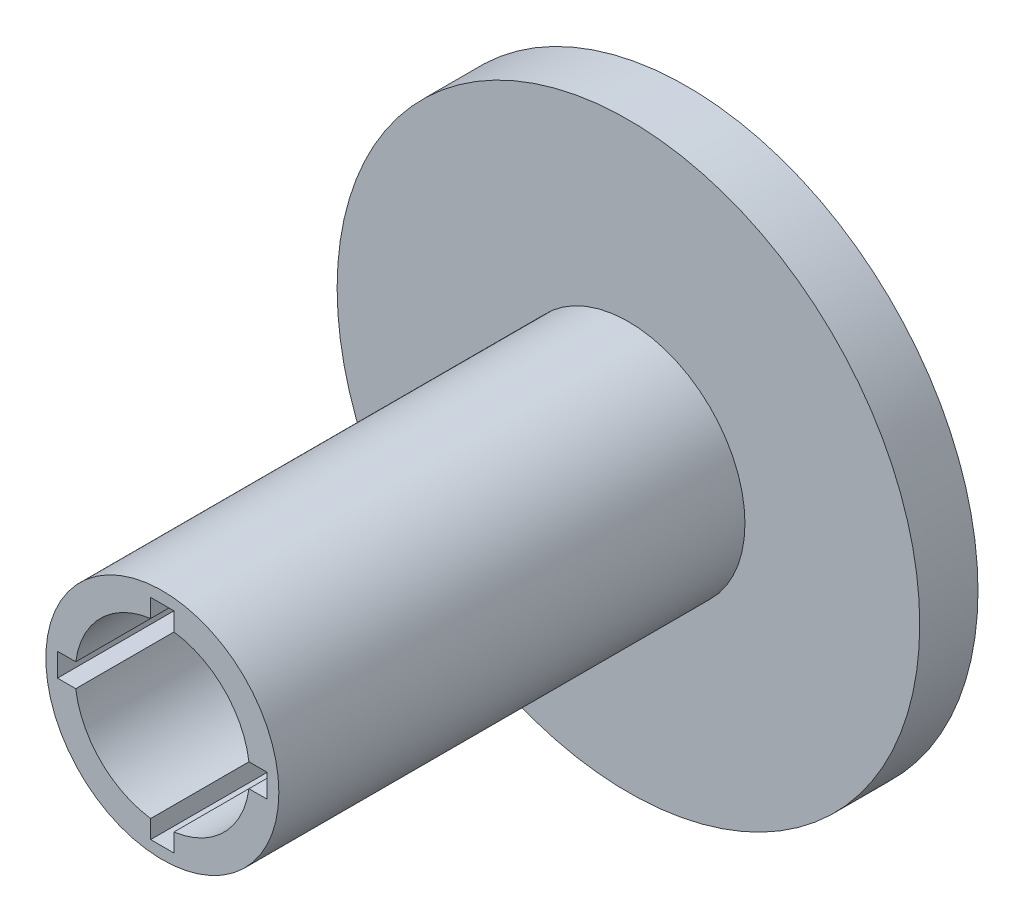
SolidWorks part; units mm, degrees
ref_plane "前视基准面" through (0, 0, 0) normal (0, 0, 1) x (1, 0, 0)
ref_plane "上视基准面" through (0, 0, 0) normal (0, 1, 0) x (1, 0, 0)
ref_plane "右视基准面" through (0, 0, 0) normal (1, 0, 0) x (0, 0, -1)
other "Configuration Table"
sketch "草图2" plane through (0, 0, 0) normal (0, 0, 1) x (1, 0, 0)
  circle A0 centre (0, 0) radius 50
  dimension "D1" = 100
extrude "凸台-拉伸1" add sketch "草图2" along normal blind 10
sketch "草图3" plane through (0, 0, 10) normal (0, 0, 1) x (1, 0, 0)
  circle A0 centre (0, 0) radius 20
  dimension "D1" = 40
extrude "凸台-拉伸2" add sketch "草图3" along normal blind 80
sketch "草图4" plane through (0, 0, 90) normal (0, 0, 1) x (1, 0, 0)
  circle A0 centre (0, 0) radius 15
  dimension "D1" = 30
extrude "切除-拉伸1" cut sketch "草图4" against normal blind 80
sketch "草图5" plane through (0, 0, 90) normal (0, 0, 1) x (1, 0, 0)
  line L1 (-2, -18) -> (2, -18)
  line L2 (-2, -18) -> (-2, 18)
  line L3 (-2, 18) -> (2, 18)
  line L4 (2, -18) -> (2, 18)
  line L5 (-2, -18) -> (2, 18) construction
  line L6 (-2, 18) -> (2, -18) construction
  line L7 (-18, 2) -> (18, 2)
  line L8 (-18, 2) -> (-18, -2)
  line L9 (-18, -2) -> (18, -2)
  line L10 (18, 2) -> (18, -2)
  line L11 (-18, 2) -> (18, -2) construction
  line L12 (-18, -2) -> (18, 2) construction
  point P0 (0, 0)
  point P6 (0, 0)
  dimension "D1" = 36
  dimension "D2" = 4
  dimension "D3" = 36
  dimension "D4" = 4
extrude "切除-拉伸2" cut sketch "草图5" against normal blind 80 contours L8 L9 L7 M5 | L9 L2 L7 M5 | L4 L9 L7 M5 | L2 L9 L4 L7 | L2 L7 L4 M5 | L4 L3 L2 M5 | L10 L7 L9 M5 | L9 L2 L4 M5 | L1 L4 L2 M5
sketch "草图6" plane through (0, 0, 0) normal (0, 0, -1) x (-1, 0, 0)
  line L1 (-2, -17.5) -> (2, -17.5)
  line L2 (-2, -17.5) -> (-2, -9.798)
  line L3 (-2, 17.5) -> (2, 17.5)
  line L4 (2, -17.5) -> (2, -9.798)
  line L7 (-17.5, 2) -> (-9.798, 2)
  line L8 (-17.5, 2) -> (-17.5, -2)
  line L9 (-17.5, -2) -> (-9.798, -2)
  line L10 (17.5, 2) -> (17.5, -2)
  line L15 (-2, 9.798) -> (-2, 17.5)
  line L18 (2, 9.798) -> (2, 17.5)
  line L19 (9.798, 2) -> (17.5, 2)
  line L22 (9.798, -2) -> (17.5, -2)
  arc A0 (-9.798, -2) -> (-2, -9.798) centre (0, 0) ccw
  arc A1 (-2, 9.798) -> (-9.798, 2) centre (0, 0) ccw
  arc A2 (9.798, 2) -> (2, 9.798) centre (0, 0) ccw
  arc A3 (2, -9.798) -> (9.798, -2) centre (0, 0) ccw
  dimension "D1" = 20
  dimension "D2" = 35
  dimension "D3" = 4
  dimension "D4" = 4
  dimension "D5" = 35
extrude "切除-拉伸3" cut sketch "草图6" against normal blind 6
sketch "草图7" plane through (0, 0, 6) normal (0, 0, -1) x (-1, 0, 0)
  line L0 (-3.0332, -4.1) -> (3.0332, -4.1)
  arc A0 (3.0332, -4.1) -> (-3.0332, -4.1) centre (0, 0) ccw
  dimension "D1" = 10.2
  dimension "D2" = 4.1
extrude "切除-拉伸4" cut sketch "草图7" against normal blind 4
